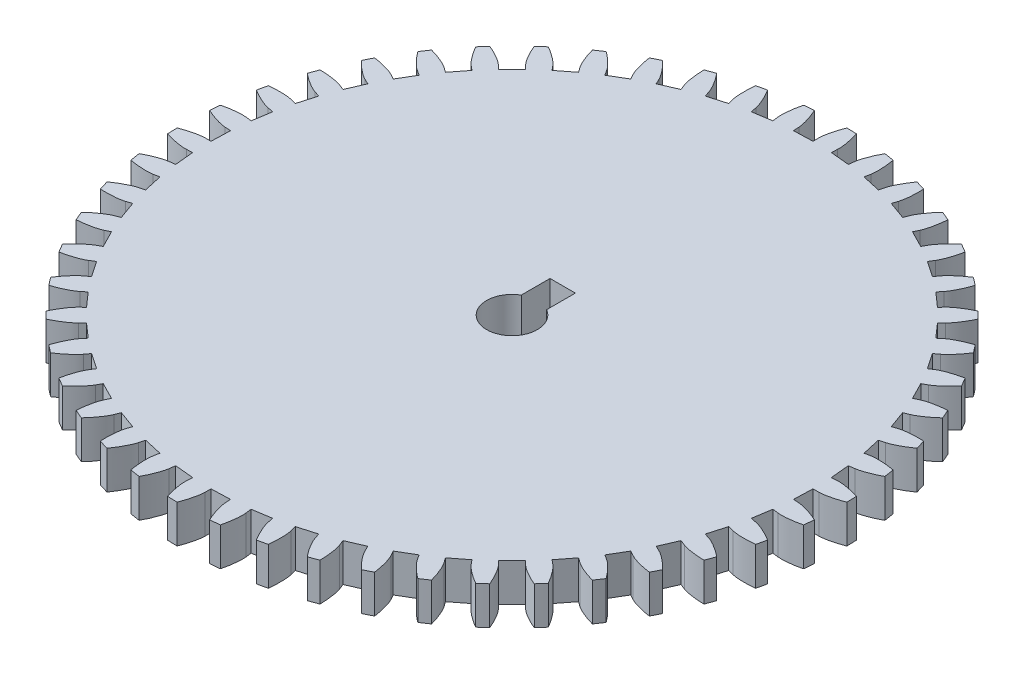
SolidWorks part; units mm, degrees
ref_plane "Front Plane" through (0, 0, 0) normal (0, 0, 1) x (1, 0, 0)
ref_plane "Top Plane" through (0, 0, 0) normal (0, 1, 0) x (1, 0, 0)
ref_plane "Right Plane" through (0, 0, 0) normal (1, 0, 0) x (0, 0, -1)
sketch "Sketch1" plane through (0, 0, 0) normal (0, 1, 0) x (1, 0, 0)
  line L0 (0, 0) -> (0, 12.1018) construction
  line L1 (0, 0) -> (-12.1018, 0) construction
  line L2 (0, 0) -> (-12.9936, -0.4083) construction
  line L3 (0, 0) -> (-12.078, -0.7599) construction
  line L4 (0, 0) -> (-12.0064, -1.5168) construction
  circle A0 centre (0, 0) radius 12.5 construction
  circle A1 centre (0, 0) radius 12.1018 construction
  circle A2 centre (0, 0) radius 11.875 construction
  circle A3 centre (0, 0) radius 13 construction
  spline S0 degree 4 poles (-12.1018, 0) (-12.123, 0) (-12.1825, -0.0022) (-12.2944, -0.0149) (-12.4752, -0.0478) (-12.7022, -0.1074) (-12.9902, -0.2042) (-13.3209, -0.3434) (-13.6737, -0.522) (-14.0442, -0.7428) (-14.4007, -0.9862) (-14.743, -1.2493) (-15.0712, -1.5296) (-15.4524, -1.8888) (-15.8861, -2.3482) (-16.356, -2.92) (-16.8432, -3.6138) (-17.2872, -4.3547) (-17.6802, -5.1234) (-17.9804, -5.8172) (-18.2073, -6.4229) (-18.3766, -6.936) (-18.5002, -7.3476) (-18.6404, -7.8721) (-18.7611, -8.3914) (-18.8636, -8.9309) (-18.9638, -9.5554) (-19.0305, -10.1179) (-19.077, -10.6083) (-19.1144, -11.2989) (-19.1236, -11.6543) (-19.1283, -12.2081) (-19.1183, -12.4606) (-19.114, -12.6843) (-19.1097, -12.7514) (-19.108, -12.7998) (-19.1071, -12.8259) knots 0 0 0 0 0 0.005377 0.015084 0.028532 0.04661 0.064855 0.092111 0.119476 0.146842 0.174209 0.201575 0.228941 0.256307 0.307035 0.361767 0.4165 0.471232 0.525964 0.580697 0.608063 0.635429 0.662795 0.690161 0.744894 0.77226 0.799626 0.854358 0.881725 0.909091 0.954545 0.977273 0.988636 0.994318 1 1 1 1 1 construction
  spline S1 degree 4 poles (-12.1018, 0) (-12.123, 0) (-12.1825, -0.0022) (-12.2944, -0.0149) (-12.4752, -0.0478) (-12.7022, -0.1074) (-12.9902, -0.2042) (-13.3209, -0.3434) (-13.6737, -0.522) (-14.0442, -0.7428) (-14.4007, -0.9862) (-14.743, -1.2493) (-15.0712, -1.5296) (-15.4524, -1.8888) (-15.8861, -2.3482) (-16.356, -2.92) (-16.8432, -3.6138) (-17.2872, -4.3547) (-17.6802, -5.1234) (-17.9804, -5.8172) (-18.2073, -6.4229) (-18.3766, -6.936) (-18.5002, -7.3476) (-18.6404, -7.8721) (-18.7611, -8.3914) (-18.8636, -8.9309) (-18.9638, -9.5554) (-19.0305, -10.1179) (-19.077, -10.6083) (-19.1034, -11.0963) (-19.1117, -11.2934) (-19.1149, -11.3914) knots 0 0 0 0 0 0.005377 0.015084 0.028532 0.04661 0.064855 0.092111 0.119476 0.146842 0.174209 0.201575 0.228941 0.256307 0.307035 0.361767 0.4165 0.471232 0.525964 0.580697 0.608063 0.635429 0.662795 0.690161 0.744894 0.77226 0.799626 0.854358 0.881725 0.909091 0.909091 0.909091 0.909091 0.909091
  dimension "D1" = 26
  dimension "D2" = 25
  dimension "D3" = 24.2037
  dimension "D4" = 23.75
  dimension "D5" = 12.1018
  dimension "D6" = 1.8
  dimension "D7" = 3.6
  dimension "D8" = 7.2
sketch "Sketch2" plane through (0, 0, 0) normal (0, 1, 0) x (1, 0, 0)
  line L0 (0, 0) -> (-12.9936, -0.4083) construction
  line L1 (0, 0) -> (-12.9936, -0.4083) construction
  line L2 (0, 0) -> (-12.078, -0.7599) construction
  line L3 (0, 0) -> (-12.1018, 0) construction
  line L4 (0, 0) -> (-12.0064, -1.5168) construction
  line L5 (0, 0) -> (-12.078, -0.7599) construction
  line L6 (0, 0) -> (-12.1018, 0) construction
  line L7 (0, 0) -> (-12.0064, -1.5168) construction
  line L8 (-12.078, -0.7599) -> (-11.8516, -0.7456)
  line L9 (-11.8516, -0.7456) -> (-11.7814, -1.4883)
  line L10 (-11.7814, -1.4883) -> (-12.0064, -1.5168) construction
  line L11 (-11.7814, -1.4883) -> (-0.9921, -0.1253)
  line L12 (-12.1018, 0) -> (-1, 0)
  circle A0 centre (0, 0) radius 11.875 construction
  circle A1 centre (0, 0) radius 12.1018 construction
  circle A2 centre (0, 0) radius 12.5 construction
  circle A3 centre (0, 0) radius 13 construction
  circle A4 centre (0, 0) radius 11.875 construction
  circle A5 centre (0, 0) radius 12.1018 construction
  circle A6 centre (0, 0) radius 12.5 construction
  circle A7 centre (0, 0) radius 13 construction
  arc A8 (-12.986, -0.6039) -> (-12.9983, -0.2127) centre (0, 0) cw
  circle A11 centre (0, 0) radius 1 construction
  arc A12 (-1, 0) -> (-0.9921, -0.1253) centre (0, 0) ccw
  spline S0 degree 4 poles (-72.4365, -1998.9619) (-8.5514, -39.6205) (-9.2103, -0.8348) (-10.9161, 0.2359) (-12.4752, -0.0478) (-12.7022, -0.1074) (-12.9902, -0.2042) (-13.3209, -0.3434) (-13.6737, -0.522) (-14.0442, -0.7428) (-14.4007, -0.9862) (-14.743, -1.2493) (-15.0712, -1.5296) (-15.4524, -1.8888) (-15.8861, -2.3482) (-16.356, -2.92) (-16.8432, -3.6138) (-17.2872, -4.3547) (-17.6802, -5.1234) (-17.9804, -5.8172) (-18.2073, -6.4229) (-18.3766, -6.936) (-18.5002, -7.3476) (-18.6404, -7.8721) (-18.7611, -8.3914) (-18.8636, -8.9309) (-18.9638, -9.5554) (-19.0305, -10.1179) (-19.2372, -12.2989) (-19.1319, -17.0789) (-16.744, 39.3584) (-84.0555, -2010.1845) knots -0.35521 -0.35521 -0.35521 -0.35521 -0.35521 0.005377 0.015084 0.028532 0.04661 0.064855 0.092111 0.119476 0.146842 0.174209 0.201575 0.228941 0.256307 0.307035 0.361767 0.4165 0.471232 0.525964 0.580697 0.608063 0.635429 0.662795 0.690161 0.744894 0.77226 0.799626 0.854358 0.881725 1.380796 1.380796 1.380796 1.380796 1.380796 only from (-12.1018, 0) to (-19.1149, -11.3914) construction
  spline S1 degree 4 poles (-12.1018, 0) (-12.123, 0) (-12.1825, -0.0022) (-12.2944, -0.0149) (-12.4752, -0.0478) (-12.6787, -0.1012) (-12.8422, -0.1547) (-12.9538, -0.1957) (-12.9983, -0.2127) knots 0 0 0 0 0 0.005377 0.015084 0.028532 0.04661 0.058695 0.058695 0.058695 0.058695 0.058695
  spline S2 degree 4 poles (-12.078, -0.7599) (-12.0991, -0.7612) (-12.1586, -0.7628) (-12.271, -0.7571) (-12.4536, -0.7356) (-12.6601, -0.6951) (-12.8266, -0.652) (-12.9405, -0.6181) (-12.986, -0.6039) knots 0 0 0 0 0 0.005377 0.015084 0.028532 0.04661 0.058695 0.058695 0.058695 0.058695 0.058695
  point P21 (-11.8516, -0.7456)
  point P24 (-11.7814, -1.4883)
  dimension "D2" = 2
extrude "Boss-Extrude1" add sketch "Sketch2" along normal blind 1.5
pattern_circular "CirPattern1" count 50 over 360 of "Boss-Extrude1"
sketch "Sketch3" plane through (0, 1.5, 0) normal (0, 1, 0) x (1, 0, 0)
  line L1 (0.5, 0) -> (-0.5, 0)
  line L2 (0.5, 0) -> (0.5, 2)
  line L3 (0.5, 2) -> (-0.5, 2)
  line L4 (-0.5, 0) -> (-0.5, 2)
  line L5 (0.5, 0) -> (-0.5, 2) construction
  line L6 (0.5, 2) -> (-0.5, 0) construction
  circle A0 centre (0, 0) radius 1 construction
  point P0 (0, 1)
  dimension "D1" = 2
  dimension "D2" = 1
extrude "Cut-Extrude1" cut sketch "Sketch3" against normal up to surface (1.5 mm away)
equation "\"Module\"= .5"
equation "\"Number of Teeth\"= 50"
equation "\"Pressure Angle\"= 14.5deg"
equation "\"Pitch Diameter\"= \"Number of Teeth\" * \"Module\""
equation "\"Circular Pitch\"= pi * \"Module\""
equation "\"Addendum\"= \"Module\""
equation "\"Dedendum\"= 1.25 * \"Module\""
equation "\"Base Diameter\"= \"Pitch Diameter\" * cos ( \"Pressure Angle\" )"
equation "\"Base Radius\"= \"Base Diameter\" / 2"
equation "\"Width\"= 1.5"
equation "\"Outside Diameter\"= \"Pitch Diameter\" + 2 * \"Addendum\""
equation "\"D1@Sketch1\"=\"Outside Diameter\""
equation "\"D3@Sketch1\"=\"Base Diameter\""
equation "\"Root Diameter\"= \"Pitch Diameter\" - 2 * \"Dedendum\""
equation "\"D4@Sketch1\"=\"Root Diameter\""
equation "\"Tooth Angle\"= 360 / \"Number of Teeth\""
equation "\"D6@Sketch1\"=\"Tooth Angle\"/4"
equation "\"D7@Sketch1\"=\"Tooth Angle\"/2"
equation "\"D8@Sketch1\"=\"Tooth Angle\""
equation "\"D2@Sketch1\" = \"Pitch Diameter\""
equation "\"Shaft Diameter\" = 2"
equation "\"D1@CirPattern1\" = \"Number of Teeth\""
equation "\"D2@Sketch2\"= \"Shaft Diameter\""
equation "\"D1@Boss-Extrude1\" = \"Width\""
